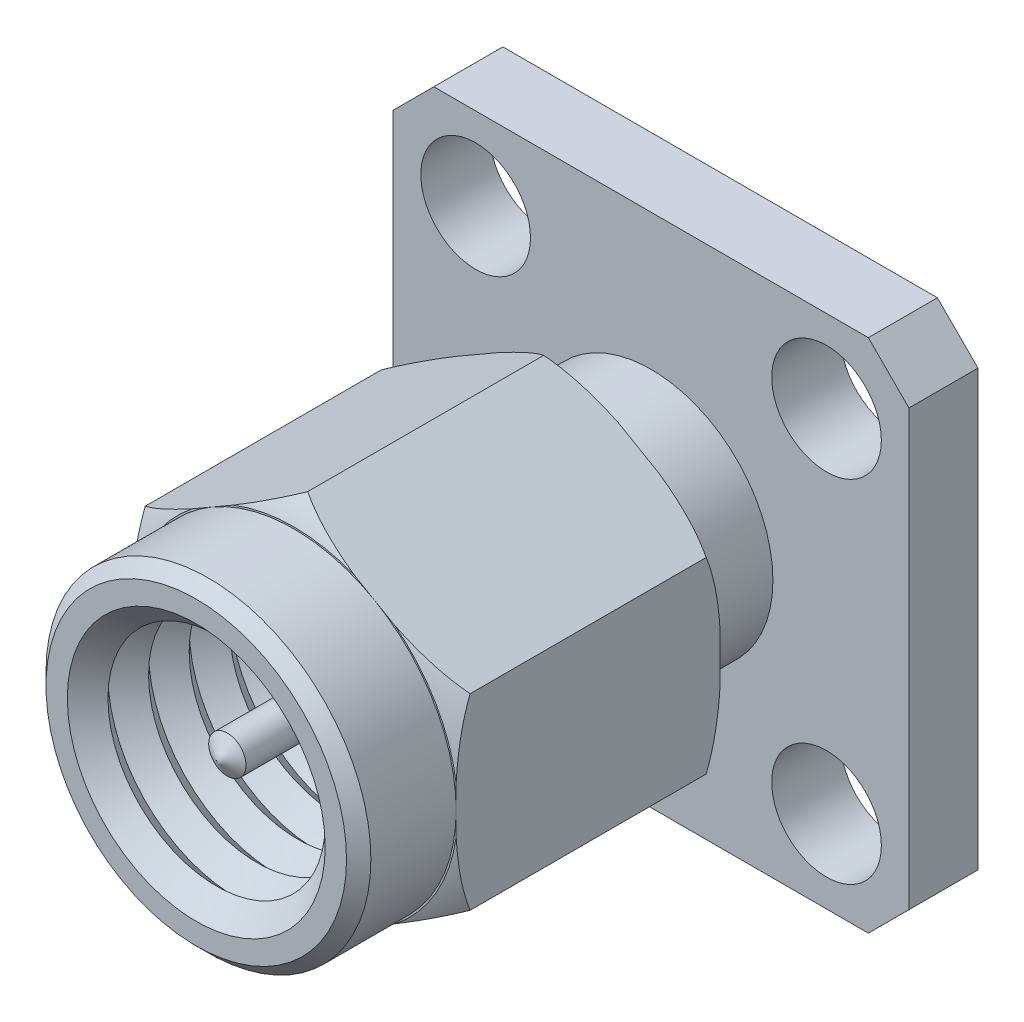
SolidWorks part; units mm, degrees
ref_plane "Front" through (0, 0, 0) normal (0, 0, 1) x (1, 0, 0)
ref_plane "Top" through (0, 0, 0) normal (0, 1, 0) x (1, 0, 0)
ref_plane "Right" through (0, 0, 0) normal (1, 0, 0) x (0, 0, -1)
sketch "Эскиз1" plane through (0, 0, 0) normal (1, 0, 0) x (0, 0, -1)
  line L0 (2, 0) -> (2, 0.635)
  line L1 (2, 0.635) -> (0.2, 0.635)
  line L2 (0.2, 0.635) -> (0.2, 2.05)
  line L3 (0.2, 2.05) -> (0, 2.05)
  line L4 (0, 2.05) -> (0, 3)
  line L5 (0, 3) -> (-4, 3)
  line L6 (-4, 3) -> (-4, 4)
  line L7 (-12.4, 0) -> (-12.1344, 0.46)
  line L8 (-12.9, 3.175) -> (-12.4, 2.675)
  line L9 (-4, 4) -> (-12.6, 4)
  line L10 (-12.9, 3.7) -> (-12.9, 3.175)
  line L11 (-12.4, 0) -> (2, 0) construction
  line L12 (-12.4, 2.675) -> (-11.9, 3.175)
  line L13 (-12.1344, 0.46) -> (-5.9, 0.46)
  line L14 (-5.9, 0.46) -> (-5.9, 3.175)
  line L15 (-11.9, 3.175) -> (-11.4, 2.675)
  line L16 (-11.4, 2.675) -> (-10.9, 3.175)
  line L17 (-10.9, 3.175) -> (-10.4, 2.675)
  line L18 (-10.4, 2.675) -> (-9.9, 3.175)
  line L19 (-9.9, 3.175) -> (-9.4, 2.675)
  line L20 (-9.4, 2.675) -> (-8.9, 3.175)
  line L21 (-8.9, 3.175) -> (-8.4, 2.675)
  line L22 (-8.4, 2.675) -> (-7.9, 3.175)
  line L23 (-7.9, 3.175) -> (-7.4, 2.675)
  line L24 (-7.4, 2.675) -> (-6.9, 3.175)
  line L25 (-6.9, 3.175) -> (-6.4, 2.675)
  line L26 (-6.4, 2.675) -> (-5.9, 3.175)
  line L27 (-12.4, 0) -> (2, 0)
  line L28 (-12.6, 4) -> (-12.9, 3.7)
  point P10 (-12.9, 4)
  dimension "D1" = 1.27
  dimension "D2" = 4.1
  dimension "D3" = 8
  dimension "D4" = 6
  dimension "D5" = 12.9
  dimension "D6" = 4
  dimension "D7" = 0.2
  dimension "D8" = 2
  dimension "D9" = 1
  dimension "D10" = 6.35
  dimension "D11" = 0.92
  dimension "D12" = 60
  dimension "D15" = 0.3
revolve "Повернуть1" add sketch "Эскиз1" angle 360 about L11
sketch "Эскиз2" plane through (0, 0, 0) normal (0, 0, 1) x (1, 0, 0)
  line L0 (-6.35, 5.35) -> (-5.35, 6.35)
  line L1 (-5.35, -6.35) -> (5.35, -6.35)
  line L2 (-6.35, -5.35) -> (-6.35, 5.35)
  line L3 (-5.35, 6.35) -> (5.35, 6.35)
  line L4 (6.35, -5.35) -> (6.35, 5.35)
  line L5 (5.35, 6.35) -> (6.35, 5.35)
  line L6 (-6.35, -5.35) -> (-5.35, -6.35)
  line L7 (5.35, -6.35) -> (6.35, -5.35)
  line L8 (0, 0) -> (0, 6.35) construction
  line L9 (-6.35, 0) -> (0, 0) construction
  point P0 (-6.35, -6.35)
  point P1 (6.35, 6.35)
  point P2 (-6.35, 6.35)
  point P3 (6.35, -6.35)
  dimension "D3" = 1
  dimension "D4" = 1
  dimension "D5" = 1
  dimension "D6" = 1
  dimension "D1" = 12.7
extrude "Вытянуть1" add sketch "Эскиз2" along normal blind 1.7
sketch "Эскиз3" plane through (0, 0, 4) normal (0, 0, -1) x (-1, 0, 0)
  line L1 (-4, 2.3094) -> (-4, -2.3094)
  line L2 (-4, -2.3094) -> (0, -4.6188)
  line L3 (0, -4.6188) -> (4, -2.3094)
  line L4 (4, -2.3094) -> (4, 2.3094)
  line L5 (4, 2.3094) -> (0, 4.6188)
  line L6 (0, 4.6188) -> (-4, 2.3094)
  circle A0 centre (0, 0) radius 4 construction
  circle A1 centre (0, 0) radius 4 construction
  circle A2 centre (0, 0) radius 3.7 construction
  circle A3 centre (0, 0) radius 3.7
extrude "Вытянуть2" add sketch "Эскиз3" against normal blind 6.5
sketch "Эскиз4" plane through (0, 0, 0) normal (1, 0, 0) x (0, 0, -1)
  line L0 (-10.5, 4.0415) -> (-10.5, 5.5)
  line L1 (-10.5, 4.6188) -> (-10.5, 3.4641) construction
  line L2 (-10.5, 5.5) -> (-8.75, 5.5)
  line L3 (-7.25, 4.6188) -> (-7.25, 6.165) construction
  line L4 (-10.5, 4.6188) -> (-4, 4.6188) construction
  line L5 (-4, 5.5) -> (-5.75, 5.5)
  line L6 (-4, 4.0415) -> (-4, 5.5)
  line L7 (0, 0) -> (-13.8316, 0) construction
  arc A0 (-8.75, 5.5) -> (-10.5, 4.0415) centre (-8.2002, 3.0612) ccw
  arc A1 (-5.75, 5.5) -> (-4, 4.0415) centre (-6.2998, 3.0612) cw
  dimension "D3" = 2.5
  dimension "D1" = 3
  dimension "D2" = 5.5
revolve "Вырез-Повернуть1" cut sketch "Эскиз4" angle 360 about L7
hole_wizard "Отверстие с зазором M2,51" positions "Эскиз6" profile "Эскиз5" hole size "M2,5" standard "ГОСТ"
sketch "Эскиз6" plane through (0, 0, 1.7) normal (0, 0, 1) x (1, 0, 0)
  line L0 (0, 0) -> (0, 6.35) construction
  line L1 (5.35, 6.35) -> (-5.35, 6.35) construction
  line L3 (0, 0) -> (-6.35, 0) construction
  line L4 (-6.35, 5.35) -> (-6.35, -5.35) construction
  point P0 (-4.32, 4.32)
  point P16 (4.32, 4.32)
  point P17 (-4.32, -4.32)
  point P19 (4.32, -4.32)
  dimension "D1" = 8.64
  dimension "D2" = 8.64
sketch "Эскиз5" plane through (-4.32, 4.32, 1.7) normal (1, 0, 0) x (0, -1, 0)
  line L0 (0, 0) -> (0, 3.7)
  line L1 (0, 3.7) -> (1.35, 3.7)
  line L2 (1.35, 3.7) -> (1.35, 0)
  line L5 (1.35, 0) -> (0, 0)
  line L11 (0, -6.35) -> (0, 107.95) construction
  dimension "Диаметр сквозного отверстия" = 2.7
  dimension "Глубина сквозного отверстия" = 3.7
